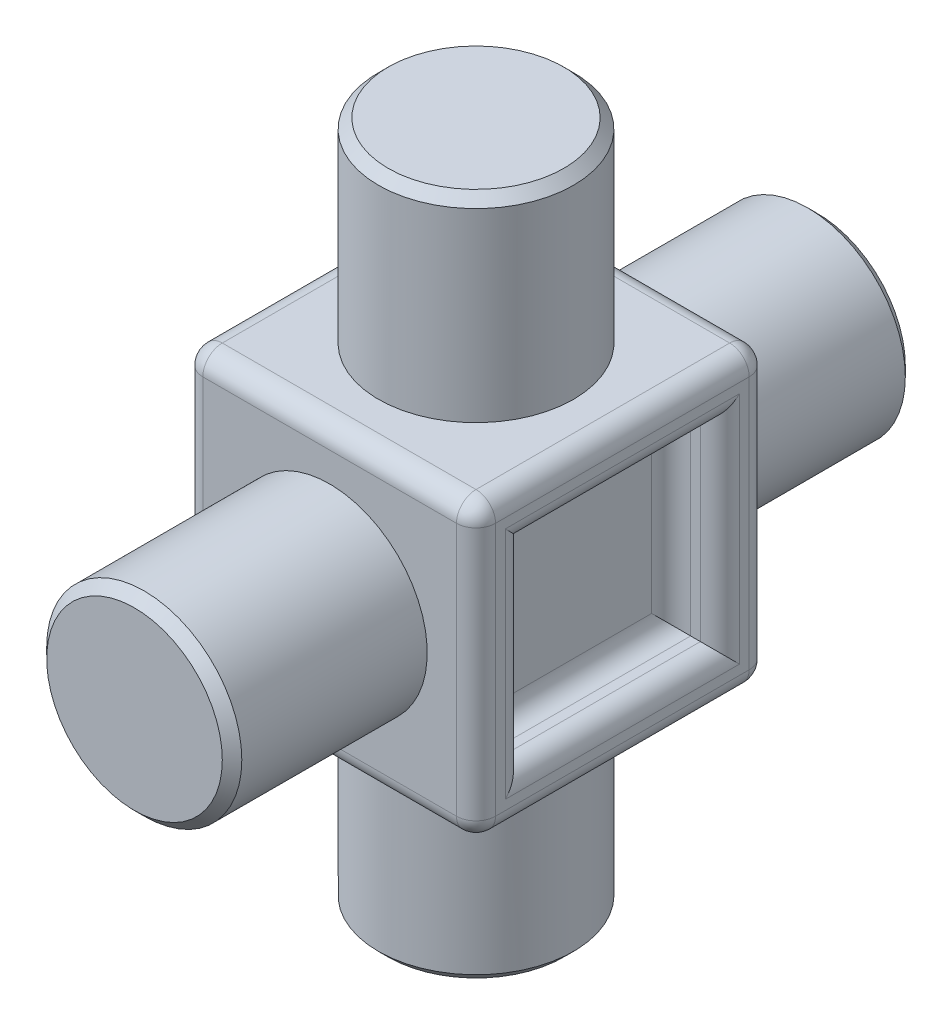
SolidWorks part; units mm, degrees
ref_plane "Plane1" through (0, 0, 0) normal (0, 0, 1) x (1, 0, 0)
ref_plane "Plane2" through (0, 0, 0) normal (0, 1, 0) x (1, 0, 0)
ref_plane "Plane3" through (0, 0, 0) normal (1, 0, 0) x (0, 0, -1)
sketch "Esquisse1" plane through (0, 0, 0) normal (0, 0, 1) x (1, 0, 0)
  line L0 (-70, 0) -> (80, 0) construction
  line L1 (0, 60) -> (0, -90) construction
  circle A0 centre (0, 0) radius 10
  dimension "D1" = 20
extrude "Base-Extrusion" add sketch "Esquisse1" along normal mid plane 70
sketch "Esquisse2" plane through (0, 0, 0) normal (0, 1, 0) x (1, 0, 0)
  circle A0 centre (0, 0) radius 10
  dimension "D1" = 20
extrude "Boss.-Extru.2" add sketch "Esquisse2" along normal mid plane 70
sketch "Esquisse3" plane through (0, 0, 0) normal (0, 0, 1) x (1, 0, 0)
  line L0 (-15, 0) -> (30, 0) construction
  line L1 (0, 30) -> (0, -29.0144) construction
  line L2 (0, 44) -> (0, 17) construction
  line L3 (15, -15) -> (-15, -15)
  line L4 (15, -15) -> (15, 15)
  line L6 (15, 15) -> (-15, 15)
  line L7 (-15, -15) -> (-15, 15)
  point P12 (0, -15)
  point P13 (0, 15)
  dimension "D1" = 30
  dimension "D2" = 30
extrude "Boss.-Extru.3" add sketch "Esquisse3" along normal mid plane 30
sketch "Esquisse4" plane through (15, 0, 0) normal (1, 0, 0) x (0, 0, -1)
  line L8 (10, -10) -> (10, 10)
  line L9 (10, 10) -> (-10, 10)
  line L10 (-10, 10) -> (-10, -10)
  line L11 (-10, -10) -> (10, -10)
  line L12 (10, -10) -> (10, 10)
  line L13 (10, 10) -> (-10, 10)
  line L14 (-10, 10) -> (-10, -10)
  line L15 (-10, -10) -> (10, -10)
  dimension "D1" = 5
extrude "Enlèv. mat.-Extru.1" cut sketch "Esquisse4" against normal blind 5
fillet "Congé1" radius 2
fillet "Congé2" radius 2
sketch "Esquisse5" plane through (-15, 0, 0) normal (-1, 0, 0) x (0, 0, 1)
  line L12 (-10, 10) -> (-10, -10)
  line L13 (-10, -10) -> (10, -10)
  line L14 (10, -10) -> (10, 10)
  line L15 (10, 10) -> (-10, 10)
  line L16 (-10, 10) -> (-10, -10)
  line L17 (-10, -10) -> (10, -10)
  line L18 (10, -10) -> (10, 10)
  line L19 (10, 10) -> (-10, 10)
  dimension "D1" = 5
extrude "Enlèv. mat.-Extru.2" cut sketch "Esquisse5" against normal blind 5
fillet "Congé3" radius 2
fillet "Congé4" radius 2
fillet "Congé5" radius 2
chamfer "Chanfrein1" distance 1 angle 45
